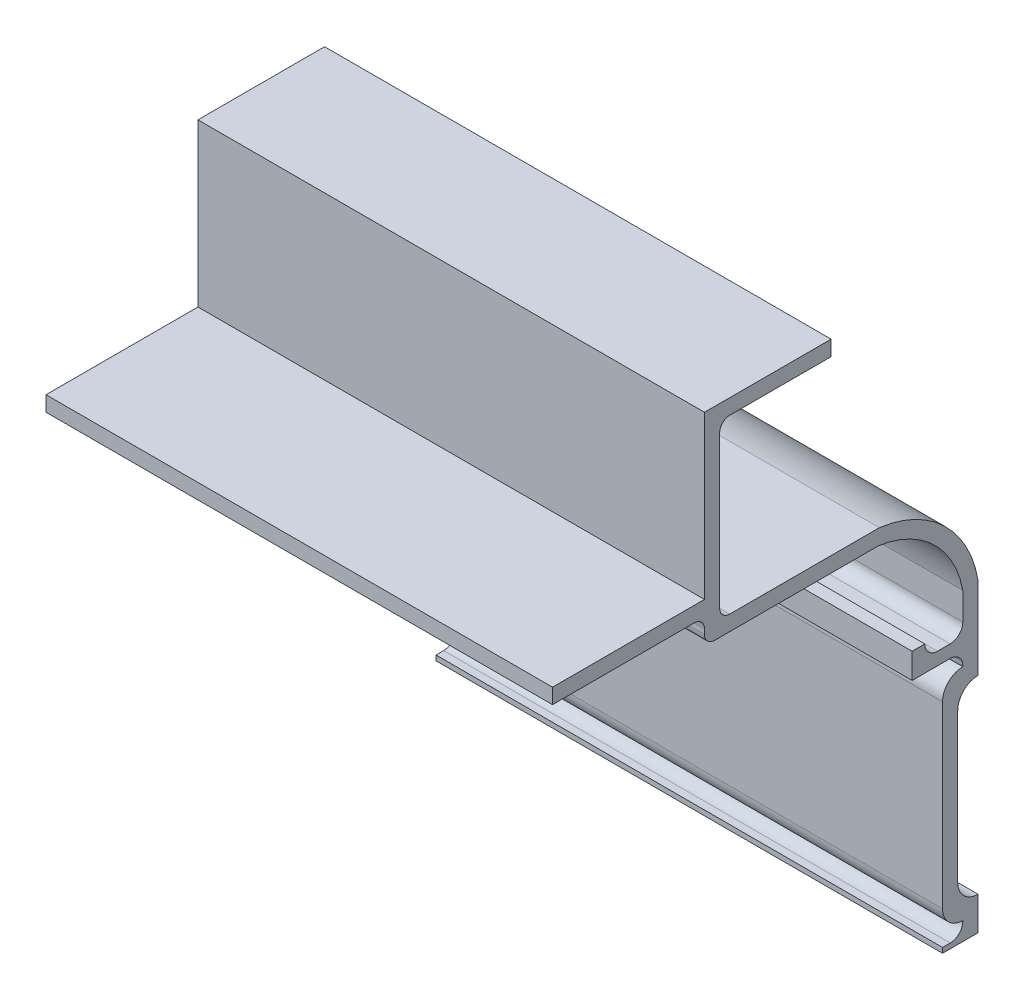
SolidWorks part; units mm, degrees
ref_plane "Front Plane" through (0, 0, 0) normal (0, 0, 1) x (1, 0, 0)
ref_plane "Top Plane" through (0, 0, 0) normal (0, 1, 0) x (1, 0, 0)
ref_plane "Right Plane" through (0, 0, 0) normal (1, 0, 0) x (0, 0, -1)
sketch "Sketch1" plane through (0, 0, 0) normal (1, 0, 0) x (0, 0, -1)
  line L0 (203.8706, 163.0459) -> (203.8706, 152.7604)
  line L1 (196.8706, 145.7604) -> (196.8706, 122.3829)
  line L2 (200.8706, 149.7604) -> (200.8706, 149.9053)
  line L3 (190.8706, 152.4053) -> (198.3706, 152.4053)
  line L4 (190.8706, 157.4053) -> (190.8706, 152.4053)
  line L5 (200.8706, 162.7872) -> (200.8706, 157.4053)
  line L6 (195.8706, 154.9053) -> (198.3706, 154.9053)
  line L7 (190.8706, 157.4053) -> (193.3706, 157.4053)
  line L9 (199.8706, 142.7604) -> (199.8706, 113.362)
  line L10 (203.8706, 152.7604) -> (203.8706, 146.7604)
  line L11 (203.8706, 109.362) -> (203.8706, 102.7604)
  line L13 (196.8706, 122.3829) -> (196.8706, 110.362)
  line L14 (203.8706, 102.7604) -> (196.8706, 102.7604)
  line L15 (196.8706, 103.7604) -> (198.3706, 103.7604)
  line L16 (196.8706, 102.7604) -> (196.8706, 103.7604)
  line L19 (174.8706, 218.7604) -> (149.8706, 218.7604)
  line L20 (174.8706, 218.7604) -> (174.8706, 215.7604)
  line L21 (149.8706, 186.7604) -> (119.8706, 186.7604)
  line L22 (119.8706, 186.7604) -> (119.8706, 183.7604)
  line L23 (174.8706, 215.7604) -> (154.8706, 215.7604)
  line L24 (152.8706, 213.7604) -> (152.8706, 183.7604)
  line L25 (154.8706, 181.7604) -> (184.3946, 181.7604)
  line L26 (149.8706, 181.7604) -> (149.8706, 180.7604)
  line L27 (147.8706, 183.7604) -> (119.8706, 183.7604)
  line L28 (149.8706, 218.7604) -> (149.8706, 186.7604)
  line L29 (151.8706, 178.7604) -> (184.1983, 178.7604)
  arc A0 (203.8706, 163.0459) -> (184.3946, 181.7604) centre (181.5447, 159.303) ccw
  arc A1 (200.8706, 162.7872) -> (184.1983, 178.7604) centre (181.5447, 159.303) ccw
  arc A2 (203.8706, 146.7604) -> (199.8706, 142.7604) centre (203.8706, 142.7604) ccw
  arc A3 (200.8706, 149.7604) -> (196.8706, 145.7604) centre (200.8706, 145.7604) ccw
  arc A4 (200.8706, 149.9053) -> (198.3706, 152.4053) centre (198.3706, 149.9053) ccw
  arc A5 (198.3706, 154.9053) -> (200.8706, 157.4053) centre (198.3706, 157.4053) ccw
  arc A6 (193.3706, 157.4053) -> (195.8706, 154.9053) centre (195.8706, 157.4053) ccw
  arc A7 (196.8706, 110.362) -> (200.8686, 106.362) centre (200.8706, 110.362) ccw
  arc A8 (199.8706, 113.362) -> (203.8706, 109.362) centre (203.8706, 113.362) ccw
  arc A9 (198.3706, 103.7604) -> (200.8686, 106.362) centre (198.3706, 106.2604) ccw
  arc A10 (154.8706, 215.7604) -> (152.8706, 213.7604) centre (154.8706, 213.7604) ccw
  arc A11 (152.8706, 183.7604) -> (154.8706, 181.7604) centre (154.8706, 183.7604) ccw
  arc A12 (149.8706, 180.7604) -> (151.8706, 178.7604) centre (151.8706, 180.7604) ccw
  arc A13 (149.8706, 181.7604) -> (147.8706, 183.7604) centre (147.8706, 181.7604) ccw
extrude "Extrude1" add sketch "Sketch1" along normal mid plane 100
